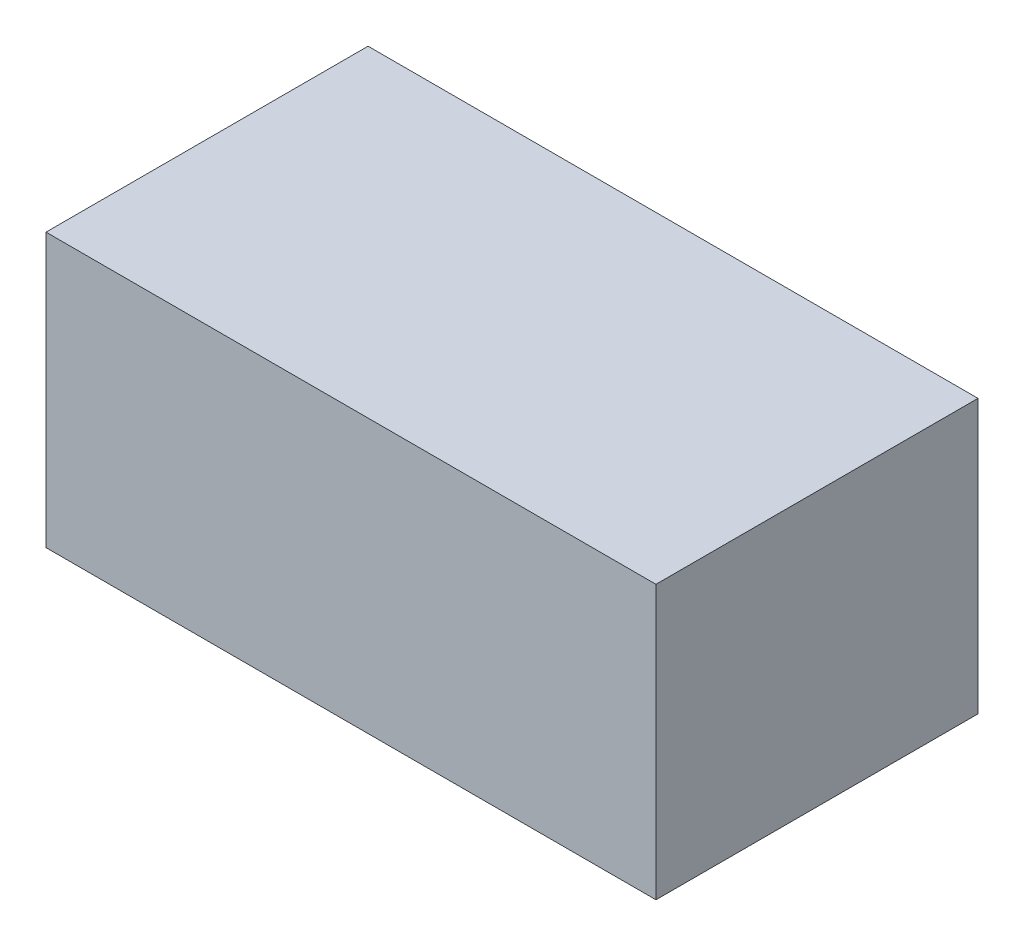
SolidWorks part; units mm, degrees
ref_plane "Front Plane" through (0, 0, 0) normal (0, 0, 1) x (1, 0, 0)
ref_plane "Top Plane" through (0, 0, 0) normal (0, 1, 0) x (1, 0, 0)
ref_plane "Right Plane" through (0, 0, 0) normal (1, 0, 0) x (0, 0, -1)
sketch "Sketch1" plane through (0, 0, 0) normal (0, 1, 0) x (1, 0, 0)
  line L1 (0, 0) -> (158.75, 0)
  line L2 (0, 0) -> (0, 83.82)
  line L3 (0, 83.82) -> (158.75, 83.82)
  line L4 (158.75, 0) -> (158.75, 83.82)
  dimension "D1" = 158.75
  dimension "D2" = 83.82
extrude "Boss-Extrude1" add sketch "Sketch1" along normal blind 71.12
